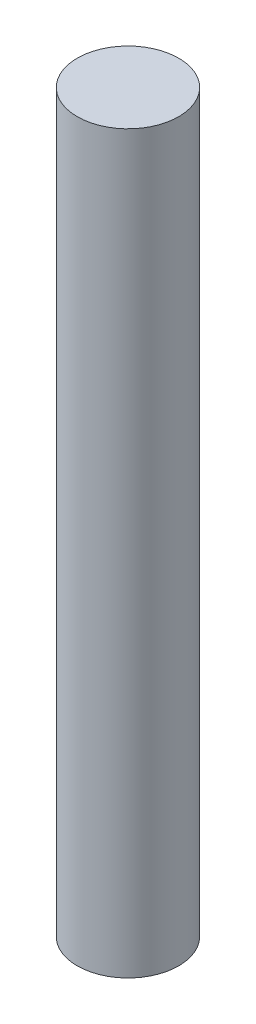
SolidWorks part; units mm, degrees
ref_plane "Front Plane" through (0, 0, 0) normal (0, 0, 1) x (1, 0, 0)
ref_plane "Top Plane" through (0, 0, 0) normal (0, 1, 0) x (1, 0, 0)
ref_plane "Right Plane" through (0, 0, 0) normal (1, 0, 0) x (0, 0, -1)
sketch "Sketch1" plane through (0, 0, 0) normal (0, 1, 0) x (1, 0, 0)
  circle A0 centre (0, 0) radius 2.54
  dimension "D1" = 5.08
extrude "Extrude1" add sketch "Sketch1" along normal mid plane 36.83
